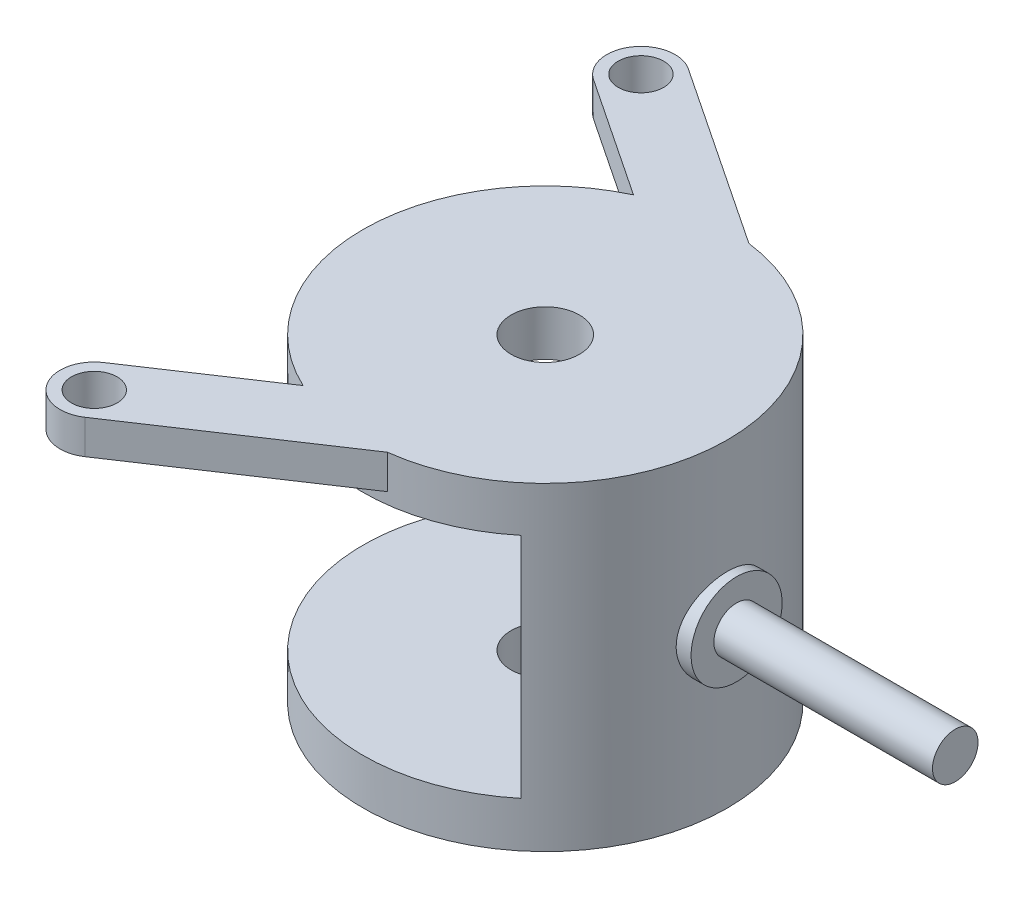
SolidWorks part; units mm, degrees
ref_plane "Vorderseite" through (0, 0, 0) normal (0, 0, 1) x (1, 0, 0)
ref_plane "Oben" through (0, 0, 0) normal (0, 1, 0) x (1, 0, 0)
ref_plane "Rechts" through (0, 0, 0) normal (1, 0, 0) x (0, 0, -1)
ref_plane "Ebene1" through (0, 270, 0) normal (0, 1, 0) x (1, 0, 0)
sketch "Skizze1" plane through (0, 270, -50) normal (0, 1, 0) x (1, 0, 0)
  line L1 (-530, -120) -> (-452, -120)
  line L3 (0, 0) -> (0, 2902.3)
  line L4 (0, 0) -> (0, -120)
  line L5 (0, -120) -> (0, -32.5)
  line L6 (0, -32.5) -> (-126, -32.5)
  line L7 (-530, 0) -> (530, 0) construction
  line L8 (530, 150) -> (530, -150)
  line L9 (-530, 150) -> (-530, -150)
  line L10 (530, -120) -> (452, -120)
  line L11 (-452, -120) -> (0, -120)
  line L12 (0, -120) -> (452, -120)
  line L13 (-530, -1040) -> (530, -1040) construction
  line L14 (0, 0) -> (0, -1040) construction
  line L15 (529.9542, -890) -> (530.0458, -1190)
  line L16 (-530.0526, -867.5292) -> (-529.9474, -1212.4708)
  line L17 (-530.0366, -920) -> (-452.0366, -919.9762)
  line L18 (529.9634, -920) -> (451.9634, -920.0238)
  line L19 (-0.0366, -920) -> (0, -1040)
  line L20 (-0.0099, -1007.5) -> (125.9901, -1007.4615)
  line L21 (-126, -32.5) -> (125.9901, -1007.4615)
  line L22 (-452.0366, -919.9762) -> (-0.0366, -920)
  line L23 (-0.0366, -920) -> (451.9634, -920.0238)
  line L24 (0, -1356) -> (0, -1040)
  line L25 (344.7172, -520) -> (0, -520)
  circle A0 centre (0, 0) radius 7.3181
  point P4 (0, 0)
  point P5 (0, 0)
  point P13 (0, 0)
  point P17 (-530, 0)
  point P19 (530, 0)
  point P30 (-530, -1040)
  point P31 (530, -1040)
  dimension "D3" = 2902.3
  dimension "D5" = 32.5
  dimension "D6" = 120
  dimension "D7" = 1060
  dimension "D8" = 78
  dimension "D9" = 120
  dimension "D10" = 120
  dimension "D11" = 452
  dimension "D14" = 300
  dimension "D15" = 1040
  dimension "D16" = 126
  dimension "D17" = 120
  dimension "D18" = 120
  dimension "D19" = 32.5
  dimension "D20" = 1007
  dimension "D21" = 316
ref_plane "Ebene6" through (0, 0, -50) normal (0, 0, 1) x (1, 0, 0)
ref_plane "Ebene2" through (0, 340, 0) normal (0, 1, 0) x (1, 0, 0)
ref_plane "Ebene3" through (0, 200, 0) normal (0, 1, 0) x (1, 0, 0)
sketch "Skizze2" plane through (0, 0, -50) normal (0, 0, 1) x (1, 0, 0)
  line L0 (530, -273.5192) -> (530, 813.5192) construction
  line L2 (50, 200) -> (-50, 200) construction
  line L3 (610, 340) -> (545, 340)
  line L4 (610, 340) -> (610, 200)
  line L5 (610, 200) -> (545, 200)
  line L7 (610, 340) -> (530, -740) construction
  line L8 (610, 200) -> (530, -599.4252) construction
  line L9 (50, 340) -> (-50, 340) construction
  line L11 (545, 340) -> (545, 200)
  point P0 (570.0819, -198.8938)
  point P8 (577.5, 200)
  dimension "D1" = 80
  dimension "D2" = 30
  dimension "D3" = 140
revolve "Rotation1" add sketch "Skizze2" angle 360 about L0
sketch "Skizze3" plane through (0, 0, -50) normal (0, 0, 1) x (1, 0, 0)
  line L1 (610, 340) -> (610, 200) construction
  line L2 (381, 220) -> (581, 220)
  line L3 (381, 220) -> (381, 320)
  line L4 (381, 320) -> (581, 320)
  line L5 (581, 220) -> (581, 320)
  line L6 (381, 220) -> (581, 320) construction
  line L7 (381, 320) -> (581, 220) construction
  line L8 (610, 340) -> (545, 340) construction
  line L9 (610, 200) -> (545, 200) construction
  point P2 (481, 270)
  dimension "D1" = 29
  dimension "D2" = 200
  dimension "D3" = 20
  dimension "D4" = 20
extrude "Schnitt-Linear austragen1" cut sketch "Skizze3" against normal mid plane 200
sketch "Skizze4" plane through (0, 0, -50) normal (0, 0, 1) x (1, 0, 0)
  line L0 (610, 270) -> (759.1423, 270) construction
  line L1 (610, 340) -> (610, 200) construction
  line L2 (-530, 270) -> (530, 270) construction
  line L3 (590, 270) -> (710, 270)
  line L4 (590, 270) -> (590, 290)
  line L5 (614, 280) -> (710, 280)
  line L6 (710, 270) -> (710, 280)
  line L7 (614, 290) -> (590, 290)
  line L9 (614, 290) -> (614, 280)
  line L10 (610, 340) -> (545, 340) construction
  line L11 (610, 200) -> (545, 200) construction
  point P8 (590, 280)
  dimension "D1" = 20
  dimension "D2" = 100
  dimension "D3" = 10
  dimension "D4" = 0
  dimension "D5" = 10
  dimension "D6" = 4
  dimension "D7" = 70
  dimension "D8" = 70
revolve "Rotation2" add sketch "Skizze4" angle 360 about L0
ref_plane "Ebene4" through (0, 220, 0) normal (0, 1, 0) x (1, 0, 0)
ref_plane "Ebene5" through (0, 325, 0) normal (0, -1, 0) x (-1, 0, 0)
sketch "Skizze5" plane through (0, 220, 0) normal (0, 1, 0) x (1, 0, 0)
  circle A0 centre (530, 50) radius 25
  circle A1 centre (530, 50) radius 15 construction
  dimension "D1" = 50
sketch "Skizze6" plane through (0, 325, 0) normal (0, -1, 0) x (-1, 0, 0)
  line L0 (-443.6823, -57.5174) -> (-496.2119, -22.5146)
  line L2 (-540.0262, -29.3692) -> (-460.3177, -82.4826)
  line L7 (-530, 200) -> (-530, -100) construction
  line L8 (-50, 50) -> (50, 50) construction
  line L9 (-443.6823, 157.5174) -> (-496.2119, 122.5146)
  line L10 (-540.0262, 129.3692) -> (-460.3177, 182.4826)
  circle A0 centre (-452, -70) radius 10
  arc A1 (-460.3177, -82.4826) -> (-443.6823, -57.5174) centre (-452, -70) ccw
  arc A7 (-540.0262, -29.3692) -> (-496.2119, -22.5146) centre (-530, 50) ccw
  arc A8 (-460.3177, 182.4826) -> (-443.6823, 157.5174) centre (-452, 170) cw
  circle A9 centre (-452, 170) radius 10
  arc A10 (-540.0262, 129.3692) -> (-496.2119, 122.5146) centre (-530, 50) cw
  dimension "D1" = 56.323
  dimension "D2" = 20
  dimension "D3" = 30
extrude "Aufsatz-Linear austragen1" add sketch "Skizze6" against normal up to surface (15 mm away)
